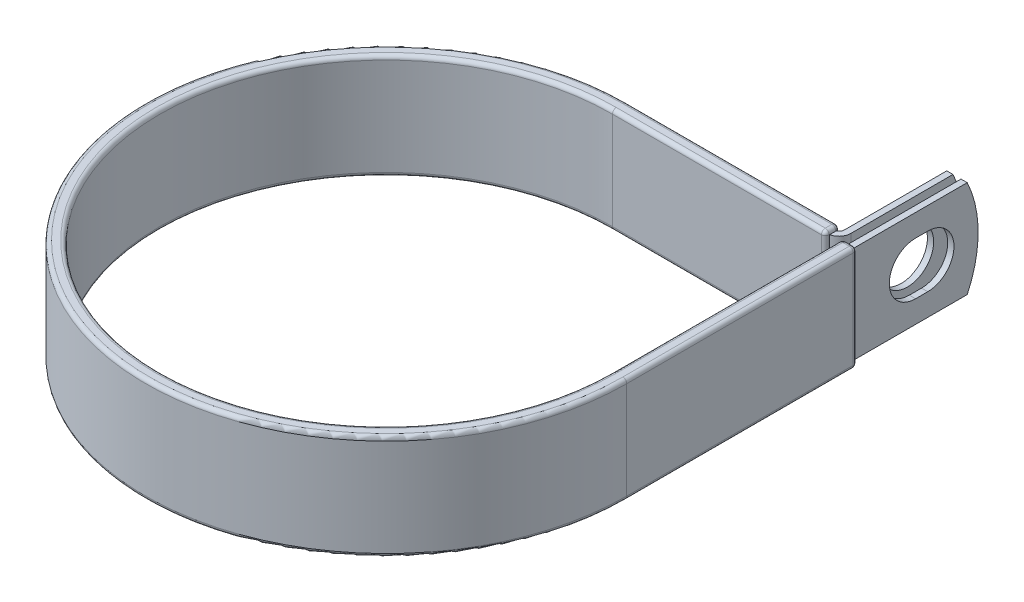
SolidWorks part; units mm, degrees
ref_plane "Front Plane" through (0, 0, 0) normal (0, 0, 1) x (1, 0, 0)
ref_plane "Top Plane" through (0, 0, 0) normal (0, 1, 0) x (1, 0, 0)
ref_plane "Right Plane" through (0, 0, 0) normal (1, 0, 0) x (0, 0, -1)
sketch "Sketch1" plane through (0, 0, 0) normal (0, 1, 0) x (1, 0, 0)
  line L0 (0, 45.2437) -> (41.2915, 45.2437)
  line L1 (45.2437, 0) -> (45.2437, 45.2437)
  line L2 (43.6689, 69.8246) -> (43.669, 47.6212)
  line L5 (45.2437, 45.2437) -> (45.2437, 69.8246)
  arc A0 (0, 45.2437) -> (45.2437, 0) centre (0, 0) ccw
  arc A3 (41.2915, 45.2437) -> (43.669, 47.6212) centre (41.2915, 47.6212) ccw
extrude "Extrude-Thin1" add sketch "Sketch1" along normal mid plane 19.05 thin
sketch "Sketch2" plane through (42.4498, 0, 0) normal (-1, 0, 0) x (0, 0, 1)
  line L0 (-69.8246, 9.525) -> (-69.8246, -9.525) construction
  line L7 (0, 9.525) -> (0, -9.525) construction
  circle A0 centre (-58.7248, 0) radius 5.1562
  point P2 (-69.8246, 0)
extrude "Cut-Extrude1" cut sketch "Sketch2" against normal up to surface (1.2192 mm away)
sketch "Sketch3" plane through (46.4629, 0, 0) normal (1, 0, 0) x (0, 0, -1)
  line L0 (57.531, 0) -> (59.9186, 0) construction
  line L1 (57.531, 5.1562) -> (59.9186, 5.1562)
  line L2 (57.531, -5.1562) -> (59.9186, -5.1562)
  line L3 (69.8246, 9.525) -> (69.8246, -9.525) construction
  arc A0 (57.531, 5.1562) -> (57.531, -5.1562) centre (57.531, 0) ccw
  arc A1 (59.9186, -5.1562) -> (59.9186, 5.1562) centre (59.9186, 0) ccw
  point P3 (58.7248, 0)
  point P8 (69.8246, 0)
  point P11 (52.3748, 0)
  point P12 (65.0748, 0)
extrude "Cut-Extrude2" cut sketch "Sketch3" against normal up to surface (1.2192 mm away)
sketch "Sketch4" plane through (42.4498, 0, 0) normal (-1, 0, 0) x (0, 0, 1)
  line L0 (-69.8246, 9.525) -> (-69.8246, -9.525)
  line L1 (-69.8246, 9.525) -> (-67.6801, 9.525)
  line L2 (-69.8246, 9.525) -> (-47.6212, 9.525) construction
  line L3 (-69.8246, -9.525) -> (-67.6801, -9.525)
  line L4 (-69.8246, -9.525) -> (-47.6212, -9.525) construction
  arc A0 (-67.6801, 9.525) -> (-67.6801, -9.525) centre (-47.5996, 0) ccw
extrude "Cut-Extrude3" cut sketch "Sketch4" against normal through all contours A0 M4 M5 | A0 L0 M2
ref_plane "Plane1" through (0, 0, -45.2437) normal (0, 0, 1) x (1, 0, 0)
ref_plane "Plane2" through (0, 0, 0) normal (-1, 0, 0) x (0, 0, 1)
sketch "Sketch5" plane through (0, 0, -45.2437) normal (0, 0, 1) x (1, 0, 0)
  line L0 (45.2437, 9.525) -> (46.4629, 9.525)
  line L1 (45.2437, -9.525) -> (45.2437, 9.525)
  line L2 (44.45, -9.5568) -> (44.45, 9.5567)
  line L3 (46.4629, 9.525) -> (46.4629, -9.525)
  line L4 (46.4629, -9.525) -> (45.2437, -9.525)
  line L5 (45.212, 10.3187) -> (46.4947, 10.3187)
  line L7 (47.2567, 9.5567) -> (47.2567, -9.5567)
  line L8 (46.4947, -10.3188) -> (45.212, -10.3188)
  line L9 (44.45, -10.3188) -> (44.45, 10.3187) construction
  line L11 (47.2567, -10.3188) -> (44.45, -10.3188) construction
  line L12 (47.2567, 10.3187) -> (47.2567, -10.3188) construction
  line L13 (44.45, 10.3187) -> (47.2567, 10.3187) construction
  arc A0 (44.45, -9.5568) -> (45.212, -10.3188) centre (45.212, -9.5568) ccw
  arc A1 (47.2567, -9.5567) -> (46.4947, -10.3188) centre (46.4947, -9.5568) cw
  arc A2 (44.45, 9.5567) -> (45.212, 10.3187) centre (45.212, 9.5567) cw
  arc A3 (46.4947, 10.3187) -> (47.2567, 9.5567) centre (46.4947, 9.5567) cw
sketch "Sketch6" plane through (0, 9.525, 0) normal (0, 1, 0) x (1, 0, 0)
  line L0 (44.45, 0) -> (44.45, 45.2437)
  line L1 (0, 44.45) -> (41.8148, 44.45)
  line L2 (42.4498, 67.6801) -> (42.4498, 47.6212) construction
  arc A0 (0, 44.45) -> (44.45, 0) centre (0, 0) ccw
sweep "Sweep1" add profiles "Sketch5" path "Sketch6"
fillet "Fillet1" radius 0.762 16 edges at (41.8148, 10.0956, -47.0335) (41.8148, 0, -47.2567) (41.8148, -10.0956, -47.0335) (41.8148, -10.3187, -45.8533) (41.8148, -10.0956, -44.6732) (41.8148, 0, -44.45) (41.8148, 10.0956, -44.6732) (47.0335, 10.0956, -45.2437) (47.2567, 0, -45.2437) (47.0335, -10.0956, -45.2437) (45.8533, -10.3187, -45.2437) (44.6732, -10.0956, -45.2437) (44.45, 0, -45.2437) (44.6732, 10.0956, -45.2437) (41.8148, 10.3187, -45.8533) (45.8533, 10.3187, -45.2437)
equation "\"D4@Sketch5\" = \"D1@Extrude-Thin1\""
equation "\"D5@Sketch5\" = \"D5@Extrude-Thin1\""
equation "\"D1@Sketch3\" = \"D2@Sketch2\""
equation "\"D7@Sketch1\" = \"D3@Sketch2\" + \"D1@Sketch3\""
equation "\"D1@Sketch1\" = \"D1@Sketch6\" + 2 * \"D3@Sketch5\""
equation "\"D1@Sketch4\" = ( \"D1@Extrude-Thin1\" + .125 ) * 2"
equation "\"D2@Sketch1\"=1.95*\"D5@Extrude-Thin1\""
equation "\"D2@Sketch3\" = \"D1@Sketch2\""
